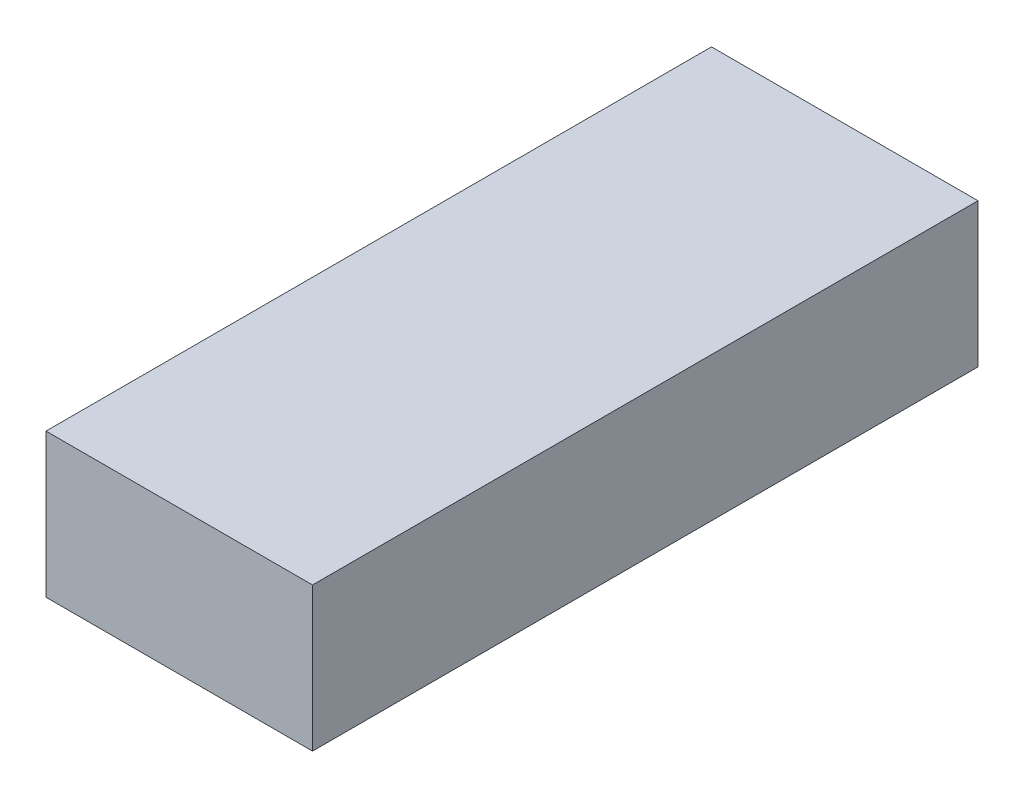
SolidWorks part; units mm, degrees
ref_plane "前视基准面" through (0, 0, 0) normal (0, 0, 1) x (1, 0, 0)
ref_plane "上视基准面" through (0, 0, 0) normal (0, 1, 0) x (1, 0, 0)
ref_plane "右视基准面" through (0, 0, 0) normal (1, 0, 0) x (0, 0, -1)
other "Configuration Table"
sketch "草图1" plane through (0, 0, 0) normal (0, 0, 1) x (1, 0, 0)
  line L1 (-3.9432, 4.3304) -> (6.0568, 4.3304)
  line L2 (-3.9432, 4.3304) -> (-3.9432, -1.0696)
  line L3 (-3.9432, -1.0696) -> (6.0568, -1.0696)
  line L4 (6.0568, 4.3304) -> (6.0568, -1.0696)
  dimension "D1" = 5.4
  dimension "D2" = 10
extrude "凸台-拉伸1" add sketch "草图1" along normal blind 24.97
